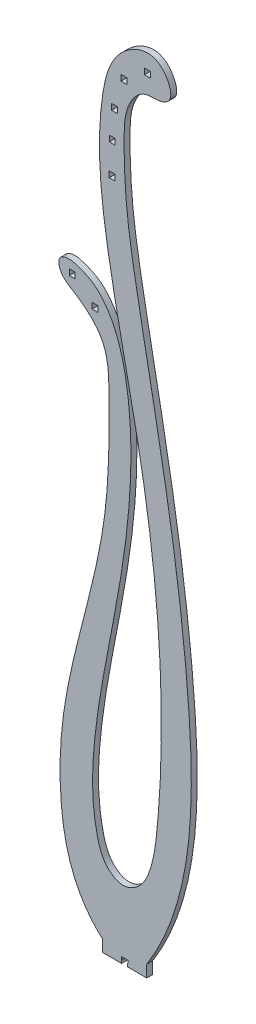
SolidWorks part; units mm, degrees
ref_plane "Alzado" through (0, 0, 0) normal (0, 0, 1) x (1, 0, 0)
ref_plane "Planta" through (0, 0, 0) normal (0, 1, 0) x (1, 0, 0)
ref_plane "Vista lateral" through (0, 0, 0) normal (1, 0, 0) x (0, 0, -1)
sketch "Croquis1" plane through (0, 0, 0) normal (0, 0, 1) x (1, 0, 0)
  line L0 (113.1667, 339.5) -> (565.8333, 339.5) construction
  line L2 (113.1667, 339.5) -> (565.8333, 339.5) construction
  line L3 (315.914, 64.718) -> (346.4768, 64.718)
  spline S0 degree 3 poles (315.914, 64.718) (294.3813, 83.5909) (284.8861, 127.7286) (288.3038, 194.4784) (304.2637, 253.2931) (320.5681, 321.7192) (320.7082, 376.2897) (320.1395, 422.7666) (300.8269, 438.8089) (286.9451, 446.2768) (284.6291, 456.8275) (292.9838, 459.8901) (300.0939, 457.3729) (309.6015, 453.6147) (319.3323, 443.864) (328.6671, 425.1795) (336.2195, 388.1278) (336.0387, 335.9044) (325.4636, 263.1149) (309.6457, 194.0334) (307.9246, 137.6889) (316.5756, 109.1468) (329.8284, 101.9495) (343.8922, 108.5956) (351.1753, 126.8768) (354.9268, 158.8558) (359.1291, 240.8514) (349.692, 330.676) (330.6504, 420.5243) (317.3117, 485.7113) (309.9519, 548.2967) (322.6112, 600.2226) (349.1832, 612.5492) (361.5933, 601.2769) (364.6543, 588.2847) (354.9175, 583.3981) (342.491, 585.425) (331.8141, 570.2581) (330.7423, 553.9594) (330.8508, 533.4535) (332.6245, 503.5473) (339.4099, 463.6444) (350.2236, 407.5009) (364.3036, 332.719) (379.7586, 213.8258) (379.726, 117.8375) (346.4768, 64.718) knots 0 0 0 0 0.042678 0.06702 0.104772 0.137936 0.176342 0.191979 0.206866 0.212439 0.216835 0.219542 0.224392 0.228484 0.235501 0.245296 0.260913 0.294273 0.326619 0.376206 0.404837 0.414995 0.420541 0.425942 0.43704 0.44947 0.476878 0.565229 0.590081 0.620936 0.669456 0.689004 0.699904 0.707032 0.713069 0.716642 0.721983 0.731887 0.74023 0.748059 0.763886 0.787217 0.8114 0.853589 0.906373 1 1 1 1
extrude "Saliente-Extruir1" add sketch "Croquis1" along normal blind 12.7
scale "Escala1" scale about centroid uniform scaling yes scale factor 3.1
sketch "Croquis3" plane through (0, -410.7945, 0) normal (0, -1, 0) x (1, 0, 0)
  line L4 (280.6324, -13.335) -> (375.3771, -13.335)
  line L5 (375.3771, -13.335) -> (375.3771, 26.035)
  line L6 (375.3771, 26.035) -> (280.6324, 26.035)
  line L7 (280.6324, 26.035) -> (280.6324, -13.335)
  line L8 (280.6324, -13.335) -> (375.3771, -13.335)
  line L9 (375.3771, -13.335) -> (375.3771, 26.035)
  line L10 (375.3771, 26.035) -> (280.6324, 26.035)
  line L11 (280.6324, 26.035) -> (280.6324, -13.335)
  dimension "D1" = 0
extrude "Saliente-Extruir3" add sketch "Croquis3" along normal blind 25.4
sketch "Croquis4" plane through (0, 0, 26.035) normal (0, 0, 1) x (1, 0, 0)
  line L0 (375.3771, -436.1945) -> (280.6324, -436.1945) construction
  line L1 (334.3548, -436.1945) -> (321.6548, -436.1945)
  line L2 (334.3548, -436.1945) -> (334.3548, -423.4945)
  line L3 (334.3548, -423.4945) -> (321.6548, -423.4945)
  line L4 (321.6548, -436.1945) -> (321.6548, -423.4945)
  point P6 (328.0048, -436.1945)
  point P7 (328.0048, -436.1945)
  dimension "D1" = 12.7
  dimension "D2" = 12.7
extrude "Cortar-Extruir2" cut sketch "Croquis4" against normal through all
sketch "Croquis5" plane through (0, 0, 26.035) normal (0, 0, 1) x (1, 0, 0)
  line L7 (334.3548, -423.4945) -> (334.3548, -436.1945)
  line L8 (334.3548, -436.1945) -> (375.3771, -436.1945)
  line L9 (375.3771, -436.1945) -> (375.3771, -410.7945)
  line L10 (280.6324, -410.7945) -> (280.6324, -436.1945)
  line L11 (280.6324, -436.1945) -> (321.6548, -436.1945)
  line L12 (321.6548, -436.1945) -> (321.6548, -423.4945)
  line L13 (321.6548, -423.4945) -> (334.3548, -423.4945)
  line L14 (334.3548, -423.4945) -> (334.3548, -436.1945)
  line L15 (334.3548, -436.1945) -> (375.3771, -436.1945)
  line L16 (375.3771, -436.1945) -> (375.3771, -410.7945)
  line L17 (280.6324, -410.7945) -> (280.6324, -436.1945)
  line L18 (280.6324, -436.1945) -> (321.6548, -436.1945)
  line L19 (321.6548, -436.1945) -> (321.6548, -423.4945)
  line L20 (321.6548, -423.4945) -> (334.3548, -423.4945)
  spline S1 degree 3 poles (-3522.4448, -714.9797) (386.706, -1205.9928) (536.7851, -396.5524) (430.6401, 420.0087) (386.9922, 651.8327) (353.4697, 825.8775) (332.4349, 949.5765) (326.9364, 1042.2857) (326.6002, 1105.8541) (329.9227, 1156.3798) (363.021, 1203.3972) (401.5432, 1197.1141) (431.7273, 1212.2623) (422.2381, 1252.5381) (383.7669, 1287.4823) (301.3937, 1249.27) (262.1498, 1088.2996) (284.9652, 894.2849) (326.3152, 692.205) (385.3441, 413.6753) (414.5992, 135.2192) (401.5719, -118.9673) (389.9422, -218.1021) (367.3649, -274.7737) (323.7671, -295.3768) (282.6834, -273.065) (255.8654, -184.5845) (261.2008, -9.9166) (310.236, 204.236) (343.0189, 429.8835) (343.5793, 591.776) (320.1669, 706.6361) (291.2289, 764.5581) (261.0638, 794.7854) (231.5899, 806.4358) (209.5487, 814.2393) (183.6491, 804.7451) (190.8287, 772.0378) (233.8622, 748.8874) (293.7314, 699.1562) (295.4944, 555.0778) (295.0599, 385.9093) (244.5164, 173.7883) (195.0407, -8.5373) (169.8406, -500.7067) (508.9196, -962.7419) (3899.1573, 1158.2494) knots -0.229242 -0.229242 -0.229242 -0.229242 0.093627 0.146411 0.1886 0.212783 0.236114 0.251941 0.25977 0.268113 0.278017 0.283358 0.286931 0.292968 0.300096 0.310996 0.330544 0.379064 0.409919 0.434771 0.523122 0.55053 0.56296 0.574058 0.579459 0.585005 0.595163 0.623794 0.673381 0.705727 0.739087 0.754704 0.764499 0.771516 0.775608 0.780458 0.783165 0.787561 0.793134 0.808021 0.823658 0.862064 0.895228 0.93298 0.957322 1.144428 1.144428 1.144428 1.144428 only from (375.3771, -410.7945) to (280.6324, -410.7945)
  spline S2 degree 3 poles (375.3771, -410.7945) (478.4496, -246.124) (478.5505, 51.4398) (430.6401, 420.0087) (386.9922, 651.8327) (353.4697, 825.8775) (332.4349, 949.5765) (326.9364, 1042.2857) (326.6002, 1105.8541) (329.9227, 1156.3798) (363.021, 1203.3972) (401.5432, 1197.1141) (431.7273, 1212.2623) (422.2381, 1252.5381) (383.7669, 1287.4823) (301.3937, 1249.27) (262.1498, 1088.2996) (284.9652, 894.2849) (326.3152, 692.205) (385.3441, 413.6753) (414.5992, 135.2192) (401.5719, -118.9673) (389.9422, -218.1021) (367.3649, -274.7737) (323.7671, -295.3768) (282.6834, -273.065) (255.8654, -184.5845) (261.2008, -9.9166) (310.236, 204.236) (343.0189, 429.8835) (343.5793, 591.776) (320.1669, 706.6361) (291.2289, 764.5581) (261.0638, 794.7854) (231.5899, 806.4358) (209.5487, 814.2393) (183.6491, 804.7451) (190.8287, 772.0378) (233.8622, 748.8874) (293.7314, 699.1562) (295.4944, 555.0778) (295.0599, 385.9093) (244.5164, 173.7883) (195.0407, -8.5373) (184.4458, -215.4615) (213.8809, -352.2885) (280.6324, -410.7945) knots 0 0 0 0 0.093627 0.146411 0.1886 0.212783 0.236114 0.251941 0.25977 0.268113 0.278017 0.283358 0.286931 0.292968 0.300096 0.310996 0.330544 0.379064 0.409919 0.434771 0.523122 0.55053 0.56296 0.574058 0.579459 0.585005 0.595163 0.623794 0.673381 0.705727 0.739087 0.754704 0.764499 0.771516 0.775608 0.780458 0.783165 0.787561 0.793134 0.808021 0.823658 0.862064 0.895228 0.93298 0.957322 1 1 1 1
  dimension "D1" = 0
extrude "Cortar-Extruir3" cut sketch "Croquis5" against normal blind 26.67
sketch "Croquis6" plane through (0, 0, -0.635) normal (0, 0, 1) x (1, 0, 0)
  line L1 (321.6548, -423.4945) -> (321.0198, -423.4945)
  line L2 (321.6548, -423.4945) -> (321.6548, -429.8445)
  line L3 (321.6548, -429.8445) -> (321.0198, -429.8445)
  line L4 (321.0198, -423.4945) -> (321.0198, -429.8445)
  line L5 (334.3548, -423.4945) -> (334.9898, -423.4945)
  line L6 (334.3548, -423.4945) -> (334.3548, -429.8445)
  line L7 (334.3548, -429.8445) -> (334.9898, -429.8445)
  line L8 (334.9898, -423.4945) -> (334.9898, -429.8445)
  dimension "D1" = 6.35
  dimension "D2" = 0.635
  dimension "D3" = 0.635
  dimension "D4" = 6.35
extrude "Cortar-Extruir4" cut sketch "Croquis6" against normal through all
sketch "Croquis7" plane through (0, 0, -0.635) normal (0, 0, 1) x (1, 0, 0)
  line L0 (320.1926, 1208.4428) -> (332.8926, 1208.4428)
  line L1 (370.4447, 1245.339) -> (383.1447, 1245.339)
  line L2 (370.4447, 1245.339) -> (370.4447, 1232.639)
  line L3 (370.4447, 1232.639) -> (383.1447, 1232.639)
  line L4 (383.1447, 1245.339) -> (383.1447, 1232.639)
  line L5 (320.1926, 1208.4428) -> (320.1926, 1195.7428)
  line L6 (320.1926, 1195.7428) -> (332.8926, 1195.7428)
  line L7 (332.8926, 1208.4428) -> (332.8926, 1195.7428)
  line L8 (300.2405, 1144.6368) -> (312.9405, 1144.6368)
  line L9 (300.2405, 1144.6368) -> (300.2405, 1131.9368)
  line L10 (300.2405, 1131.9368) -> (312.9405, 1131.9368)
  line L11 (312.9405, 1144.6368) -> (312.9405, 1131.9368)
  line L12 (295.3682, 1083.592) -> (308.0682, 1083.592)
  line L13 (295.3682, 1083.592) -> (295.3682, 1070.892)
  line L14 (295.3682, 1070.892) -> (308.0682, 1070.892)
  line L15 (308.0682, 1083.592) -> (308.0682, 1070.892)
  line L16 (295.1281, 1017.1298) -> (307.8281, 1017.1298)
  line L17 (295.1281, 1017.1298) -> (295.1281, 1004.4298)
  line L18 (295.1281, 1004.4298) -> (307.8281, 1004.4298)
  line L19 (307.8281, 1017.1298) -> (307.8281, 1004.4298)
  line L20 (209.8226, 793.4454) -> (222.5226, 793.4454)
  line L21 (209.8226, 793.4454) -> (209.8226, 780.7454)
  line L22 (209.8226, 780.7454) -> (222.5226, 780.7454)
  line L23 (222.5226, 793.4454) -> (222.5226, 780.7454)
  line L24 (258.5306, 755.837) -> (271.2306, 755.837)
  line L25 (258.5306, 755.837) -> (258.5306, 743.137)
  line L26 (258.5306, 743.137) -> (271.2306, 743.137)
  line L27 (271.2306, 755.837) -> (271.2306, 743.137)
  point P16 (0, 0)
extrude "Cortar-Extruir7" cut sketch "Croquis7" against normal through all
